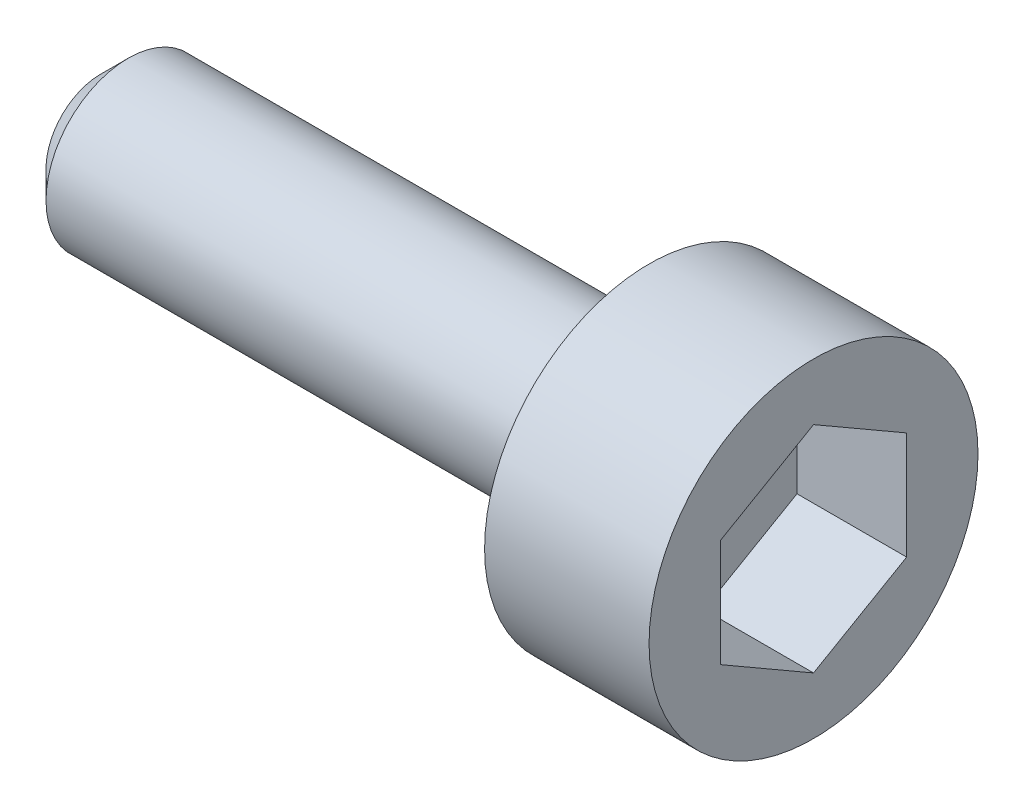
SolidWorks part; units mm, degrees
ref_plane "Plan de face" through (0, 0, 0) normal (0, 0, 1) x (1, 0, 0)
ref_plane "Plan de dessus" through (0, 0, 0) normal (0, 1, 0) x (1, 0, 0)
ref_plane "Plan de droite" through (0, 0, 0) normal (1, 0, 0) x (0, 0, -1)
sketch "Esquisse1" plane through (0, 0, 0) normal (0, 0, 1) x (1, 0, 0)
  line L0 (-28.3118, 0) -> (48.5141, 0) construction
  line L1 (0, 0) -> (0, 1.5)
  line L2 (0, 1.5) -> (10, 1.5)
  line L3 (10, 1.5) -> (10, 3)
  line L4 (10, 3) -> (13, 3)
  line L5 (13, 3) -> (13, 0)
  line L6 (0, 0) -> (13, 0)
  dimension "D1" = 3
  dimension "D2" = 10
  dimension "D3" = 3
  dimension "D4" = 6
revolve "Révolution1" add sketch "Esquisse1" angle 360 about L0
chamfer "Chanfrein1" distance 0.5 angle 45 1 edges at (0, 0, 1.5)
sketch "Esquisse2" plane through (13, 0, 0) normal (1, 0, 0) x (0, 0, -1)
  line L1 (0, -1.9613) -> (1.6986, -0.9807)
  line L2 (1.6986, -0.9807) -> (1.6986, 0.9807)
  line L3 (1.6986, 0.9807) -> (0, 1.9613)
  line L4 (0, 1.9613) -> (-1.6986, 0.9807)
  line L5 (-1.6986, 0.9807) -> (-1.6986, -0.9807)
  line L6 (-1.6986, -0.9807) -> (0, -1.9613)
  circle A0 centre (0, 0) radius 1.6986 construction
extrude "Enlèv. mat.-Extru.1" cut sketch "Esquisse2" against normal blind 2
